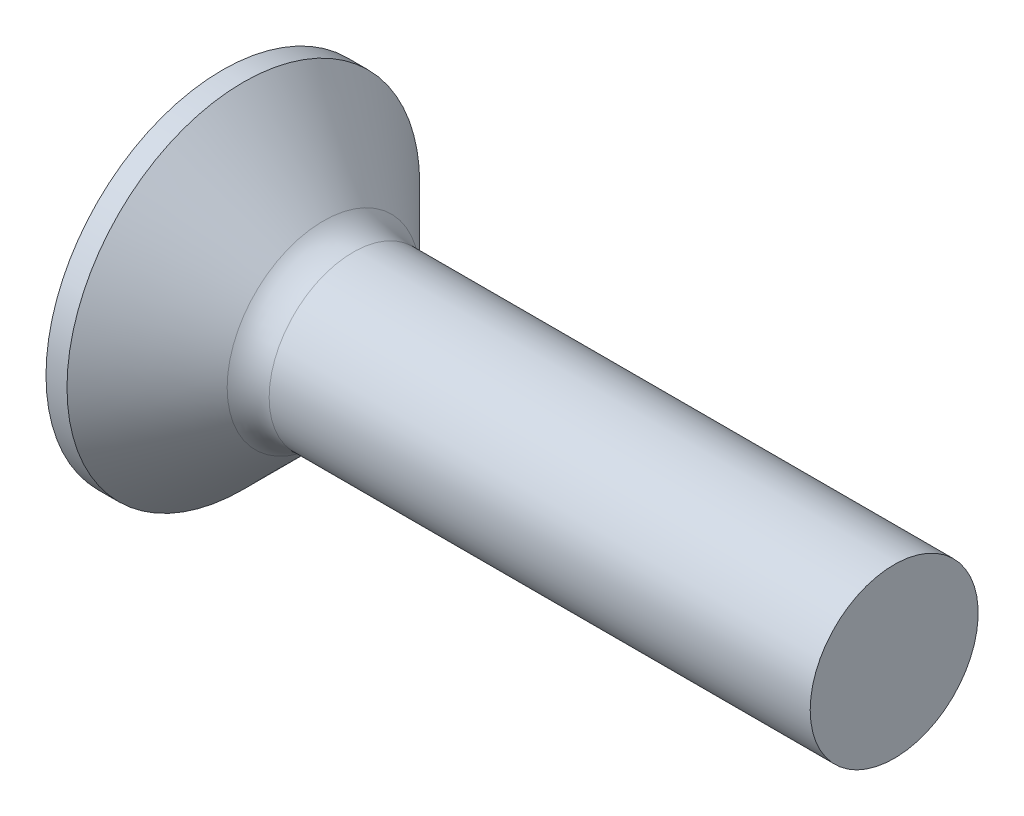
SolidWorks part; units mm, degrees
ref_plane "Plane1" through (0, 0, 0) normal (0, 0, 1) x (1, 0, 0)
ref_plane "Plane2" through (0, 0, 0) normal (0, 1, 0) x (1, 0, 0)
ref_plane "Plane3" through (0, 0, 0) normal (1, 0, 0) x (0, 0, -1)
sketch "BodySke" plane through (0, 0, 0) normal (0, 0, 1) x (1, 0, 0)
  line L0 (0, 0) -> (0, 4.2)
  line L1 (0, 4.2) -> (0.5, 4.2)
  line L2 (2.7, 2) -> (16, 2)
  line L3 (16, 2) -> (16, 0)
  line L4 (16, 0) -> (0, 0)
  line L5 (-6.35, 0) -> (82.55, 0) construction
  line L6 (2.7, -2) -> (16, -2) construction
  line L7 (0.5, -4.2) -> (2.7, -2) construction
  line L8 (0.5, 4.2) -> (2.7, 2)
  line L9 (0, -4.2) -> (0.5, -4.2) construction
  line L10 (3.4, 3.5875) -> (3.4, -5.9375) construction
  line L11 (0, 6.35) -> (0, -3.175) construction
  dimension "Diameter" = 4
  dimension "Length" = 16
  dimension "Head_ht" = 2.7
  dimension "Head_dia" = 8.4
  dimension "Head_ang" = 90
  dimension "D6" = 0.5
  dimension "Advance" = 0.7
  dimension "Thread_nom" = 16
revolve "Base-Revolve" add sketch "BodySke"
fillet "Fillet1" radius 1 1 edges at (2.7, 0, 2)
sketch "Sketch3" plane through (0, 0, 0) normal (-1, 0, 0) x (0, 0, 1)
  line L0 (-0.515, 2.2) -> (0.515, 2.2)
  line L1 (0.515, 2.2) -> (0.515, -2.2)
  line L2 (0.515, -2.2) -> (-0.515, -2.2)
  line L3 (-0.515, -2.2) -> (-0.515, 2.2)
  dimension "D1" = 2.2
  dimension "Cross_dia" = 4.4
  dimension "D2" = 0.515
  dimension "Cross_width" = 1.03
ref_plane "Plane4" through (2.51, 0, 0) normal (-1, 0, 0) x (0, 0, 1)
sketch "Sketch4" plane through (2.51, 0, 0) normal (-1, 0, 0) x (0, 0, 1)
  line L0 (-0.515, 0.9486) -> (0.515, 0.9486)
  line L3 (0.515, 0.9486) -> (0.515, -0.9486)
  line L4 (0.515, -0.9486) -> (-0.515, -0.9486)
  line L5 (-0.515, -0.9486) -> (-0.515, 0.9486)
  dimension "D1" = 1.03
  dimension "D2" = 1.8971
  dimension "D3" = 0.515
  dimension "D4" = 0.9486
loft "Recess" cut profiles "Sketch3", "Sketch4"
pattern_circular "RecPat" count 2 every 90 about axis through (0, 0, 0) along (1, 0, 0) of "Recess"
sketch "RecCorSke" plane through (0, 0, 0) normal (0, 0, 1) x (1, 0, 0)
  line L0 (-3.175, 0) -> (15.875, 0) construction
  line L2 (0, 0) -> (0, 1.0265)
  line L3 (0, 1.0265) -> (2.51, 0.851)
  line L4 (2.51, 0.851) -> (2.7865, 0)
  line L5 (2.7865, 0) -> (0, 0)
  dimension "Diameter" = 1.702
  dimension "Depth" = 2.51
  dimension "Draft_angle" = 4
  dimension "Bottom_angle" = 18
revolve "RecessCore" cut sketch "RecCorSke" angle 360 about L0
sketch "ThdSchSke" plane through (0, 0, 0) normal (0, 0, 1) x (1, 0, 0)
  line L0 (3.4, -1.61) -> (3.1269, -2)
  line L1 (3.4, -1.61) -> (3.6731, -2)
  line L2 (3.6731, -2) -> (3.6731, -2.5)
  line L3 (-3.175, 0) -> (5.1513, 0) construction
  line L5 (3.6731, -2.5) -> (3.1269, -2.5)
  line L6 (3.1269, -2.5) -> (3.1269, -2)
  line L7 (0, 4.2) -> (0, -4.2) construction
  dimension "Thread_minor" = 3.22
  dimension "Diameter" = 4
  dimension "Start" = 3.4
  dimension "SideAngle" = 55
  dimension "VeeAngle" = 70
  dimension "Overcut" = 5
revolve "ThreadSchematic" [suppressed] cut sketch "ThdSchSke" angle 360 about L3
pattern_linear "ThdSchPat" [suppressed]
equation "\"D1@Sketch3\" = \"Cross_dia@Sketch3\" / 2"
equation "\"D2@Sketch3\" = \"Cross_width@Sketch3\" / 2"
equation "\"Depth@RecCorSke\" = \"Cross_depth@Plane4\""
equation "\"D1@Sketch4\" = \"Cross_width@Sketch3\""
equation "\"D2@Sketch4\" = \"Cross_dia@Sketch3\" - 2.0 * \"Cross_depth@Plane4\" * tan(26.5  * 0.017453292)"
equation "\"D3@Sketch4\" = \"D1@Sketch4\" / 2"
equation "\"D4@Sketch4\" = \"D2@Sketch4\" / 2"
equation "\"Thread_length@ThreadCosmetic\" = ((sgn( (\"Length@BodySke\" - \"Advance@BodySke\" * 1.0 - \"Head_ht@BodySke\" ) - \"Thread_nom@BodySke\" )-1)*( (\"Length@BodySke\" - \"Advance@BodySke\" * 1.0 - \"Head_ht@BodySke\" "
equation "\"Thread_minor@ThdSchSke\" = \"Thread_minor@ThreadCosmetic\""
equation "\"Diameter@ThdSchSke\" = \"Diameter@BodySke\""
equation "\"Overcut@ThdSchSke\" = \"Diameter@BodySke\" * 1.25"
equation "\"Start@ThdSchSke\" = 0.000001 + \"Length@BodySke\" - \"Thread_length@ThreadCosmetic\"  '---Countersunk---"
equation "\"Num_threads@ThdSchPat\" = int( \"Thread_length@ThreadCosmetic\" / \"Advance@BodySke\" + 0.999 )  + 1"
equation "\"Advance@ThdSchPat\" = \"Thread_length@ThreadCosmetic\" /  (\"Num_threads@ThdSchPat\" - 1) 'relax it"
